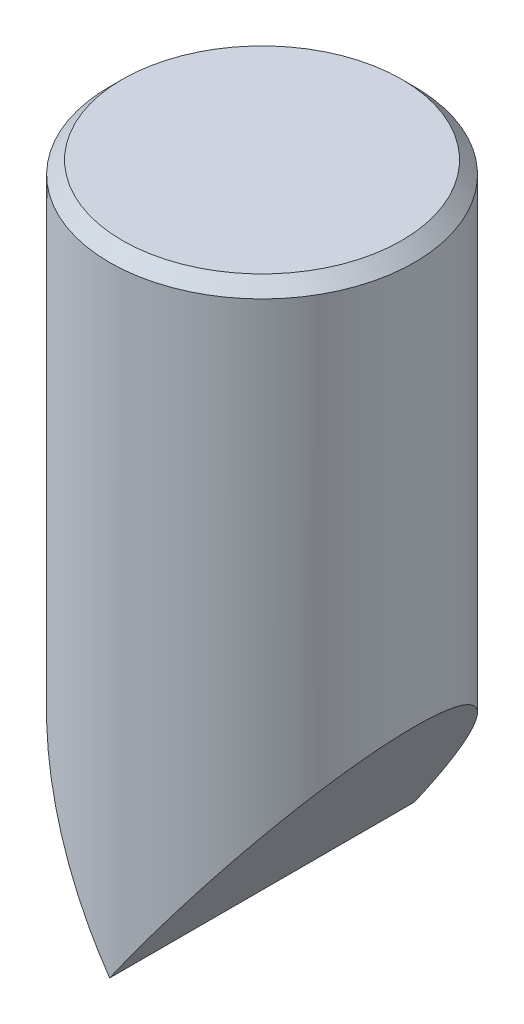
SolidWorks part; units mm, degrees
ref_plane "Спереди" through (0, 0, 0) normal (0, 0, 1) x (1, 0, 0)
ref_plane "Сверху" through (0, 0, 0) normal (0, 1, 0) x (1, 0, 0)
ref_plane "Справа" through (0, 0, 0) normal (1, 0, 0) x (0, 0, -1)
sketch "Эскиз1" plane through (0, 0, 0) normal (0, 1, 0) x (1, 0, 0)
  circle A0 centre (0, 0) radius 3
  dimension "D1" = 6
extrude "Бобышка-Вытянуть1" add sketch "Эскиз1" along normal blind 12.45
sketch "Эскиз2" plane through (0, 0, 0) normal (0, 0, 1) x (1, 0, 0)
  line L0 (0, 0) -> (-3, 4.2844)
  line L1 (-3, 12.45) -> (-3, 0) construction
  line L2 (0, 0) -> (0, 12.45) construction
  line L3 (3, 12.45) -> (-3, 12.45) construction
  line L4 (0, 0) -> (3, 4.2844)
  line L5 (-3, 4.2844) -> (-4.2237, 4.2844)
  line L6 (-4.2237, 4.2844) -> (-4.2237, -0.928)
  line L7 (-4.2237, -0.928) -> (4.7141, -0.928)
  line L8 (4.7141, -0.928) -> (4.7141, 4.2844)
  line L9 (4.7141, 4.2844) -> (3, 4.2844)
  dimension "D1" = 70
extrude "Вырез-Вытянуть1" cut sketch "Эскиз2" against normal mid plane 7
chamfer "Фаска1" distance 0.25 angle 45 1 edges at (0, 12.45, 3)
